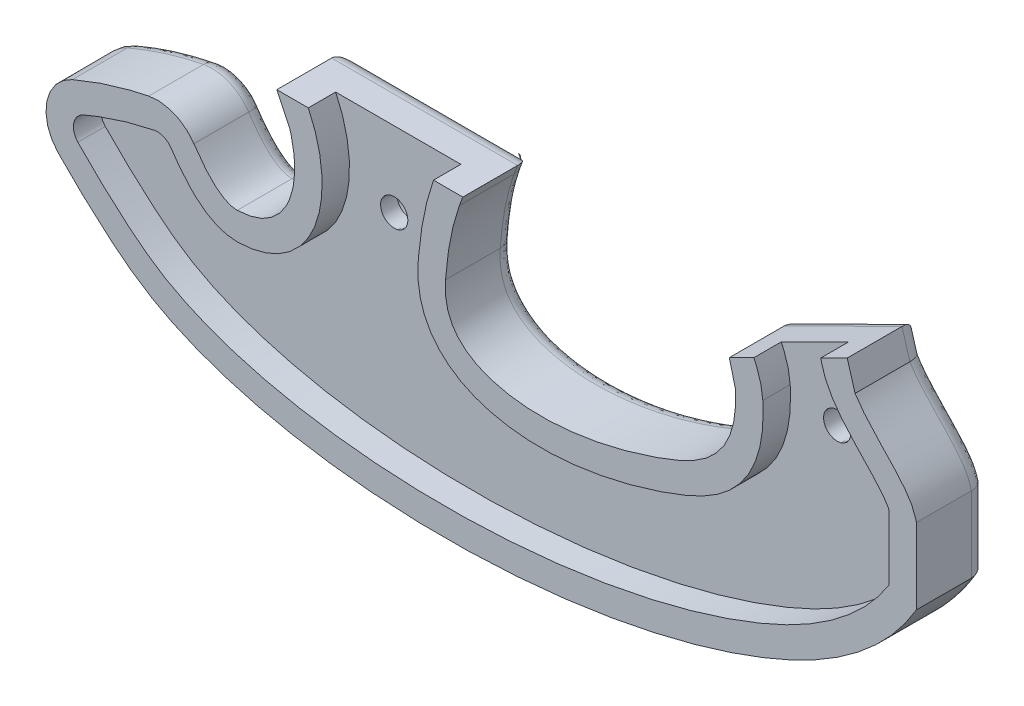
SolidWorks part; units mm, degrees
ref_plane "Front Plane" through (0, 0, 0) normal (0, 0, 1) x (1, 0, 0)
ref_plane "Top Plane" through (0, 0, 0) normal (0, 1, 0) x (1, 0, 0)
ref_plane "Right Plane" through (0, 0, 0) normal (1, 0, 0) x (0, 0, -1)
sketch "Sketch1" plane through (0, 0, 0) normal (0, 0, 1) x (1, 0, 0)
  line L0 (79.2504, -115.4644) -> (79.2504, -101.6424)
  line L5 (0, 0) -> (0, 0)
  line L12 (-35.1375, -96.6123) -> (-37.5102, -91.6123)
  line L13 (68.0435, -86.8465) -> (66.6096, -81.9755)
  line L14 (49.5621, -90.4507) -> (45.0848, -92.6766)
  line L15 (-3.553, -91.6123) -> (-8.908, -91.6123)
  line L16 (-67.1249, -96.6857) -> (-37.5102, -91.6123) construction
  line L17 (-64.2501, -101.266) -> (-37.085, -96.6123) construction
  line L18 (66.6096, -81.9755) -> (81.1993, -47.4105) construction
  line L19 (70.4952, -85.6276) -> (86.1993, -48.4225) construction
  line L20 (81.1993, 47.4105) -> (66.6096, 81.9755) construction
  line L21 (86.1993, 48.4225) -> (70.4952, 85.6276) construction
  line L22 (74.2504, 114.0311) -> (-73.8224, 118.0757) construction
  line L23 (79.2504, 118.8964) -> (-75.3218, 123.1185) construction
  line L30 (-37.5102, -91.6123) -> (-31.761, -91.6123)
  line L31 (74.2504, -114.0311) -> (74.2504, -102.2592)
  line L32 (61.7915, -84.3708) -> (66.6096, -81.9755)
  line L36 (-37.085, -96.6123) -> (-35.1375, -96.6123) construction
  line L37 (-87.8722, -63.9899) -> (-87.8722, -94.5192) construction
  line L38 (-92.8722, -63.9899) -> (-92.8722, -94.5192) construction
  line L39 (-82.8722, -99.5192) -> (-71.6312, -99.5192) construction
  line L40 (-82.8722, -104.5192) -> (-71.6312, -104.5192) construction
  line L41 (68.0435, -86.8465) -> (70.4952, -85.6276) construction
  line L42 (81.1993, -47.4105) -> (81.1993, 47.4105) construction
  line L43 (86.1993, -48.4225) -> (86.1993, 48.4225) construction
  line L44 (-74.6877, 34.8695) -> (-74.6877, -34.8695) construction
  line L45 (-69.6877, 36.0776) -> (-69.6877, -36.0776) construction
  line L46 (-4.0919, -2.8841) -> (-67.1249, 96.6857) construction
  line L47 (0, 0) -> (-62.7714, 99.1566) construction
  line L48 (-56.8037, 110.4905) -> (-48.5642, 116.4338) construction
  line L49 (-53.3217, 106.8371) -> (-50.5489, 108.8371) construction
  line L50 (-48.5642, 116.4338) -> (22.8691, -37.3697) construction
  line L51 (-50.5489, 108.8371) -> (0, 0) construction
  line L52 (-71.6312, 99.5192) -> (-82.8722, 99.5192) construction
  line L53 (-71.6312, 104.5192) -> (-82.8722, 104.5192) construction
  line L54 (-72.8338, 113.2617) -> (-59.8954, 109.2083) construction
  line L55 (-74.5186, 108.5499) -> (-61.2, 104.3774) construction
  line L56 (-92.8722, 94.5192) -> (-92.8722, 63.9899) construction
  line L57 (-87.8722, 94.5192) -> (-87.8722, 63.9899) construction
  line L58 (-78.9079, 54.0436) -> (-69.6877, 36.0776) construction
  line L59 (-82.2731, 49.65) -> (-74.6877, 34.8695) construction
  line L60 (61.7915, 84.3708) -> (74.2504, 102.2592) construction
  line L61 (69.2063, 86.2684) -> (79.2504, 100.6895) construction
  line L62 (74.2504, 102.2592) -> (74.2504, 114.0311) construction
  line L63 (79.2504, 100.6895) -> (79.2504, 118.8964) construction
  line L64 (66.6096, 81.9755) -> (61.7915, 84.3708) construction
  line L65 (70.4952, 85.6276) -> (69.2063, 86.2684) construction
  line L66 (22.8691, -37.3697) -> (-4.0919, -2.8841) construction
  line L67 (-69.6877, -36.0776) -> (-78.9079, -54.0436) construction
  line L68 (-74.6877, -34.8695) -> (-82.2731, -49.65) construction
  line L69 (-4.1958, -93.2842) -> (-3.553, -91.6123)
  line L70 (51.2032, -96.3773) -> (49.5621, -90.4507) construction
  line L71 (46.2395, -97.188) -> (44.7434, -91.785) construction
  line L72 (46.2395, -97.188) -> (45.0848, -92.6766)
  arc A0 (-52.6376, -107.7258) -> (-60.8822, -104.3067) centre (-59.3034, -112.1493) ccw
  arc A1 (-74.8197, -108.673) -> (-77.4561, -121.5104) centre (-71.6422, -116.015) ccw
  arc A27 (-56.8037, -110.4905) -> (-59.8954, -109.2083) centre (-59.3034, -112.1493) ccw
  arc A28 (-72.8338, -113.2617) -> (-73.8224, -118.0757) centre (-71.6422, -116.015) ccw
  arc A30 (-92.8722, -94.5192) -> (-82.8722, -104.5192) centre (-82.8722, -94.5192) ccw construction
  arc A31 (-87.8722, -94.5192) -> (-82.8722, -99.5192) centre (-82.8722, -94.5192) ccw construction
  arc A32 (-71.6312, -104.5192) -> (-64.2501, -101.266) centre (-71.6312, -94.5192) ccw construction
  arc A33 (-71.6312, -99.5192) -> (-67.1249, -96.6857) centre (-71.6312, -94.5192) ccw construction
  arc A34 (-82.8722, 104.5192) -> (-92.8722, 94.5192) centre (-82.8722, 94.5192) ccw construction
  arc A35 (-82.8722, 99.5192) -> (-87.8722, 94.5192) centre (-82.8722, 94.5192) ccw construction
  arc A36 (-61.2, 104.3774) -> (-53.3217, 106.8371) centre (-59.3034, 112.1493) ccw construction
  arc A37 (-59.8954, 109.2083) -> (-56.8037, 110.4905) centre (-59.3034, 112.1493) ccw construction
  arc A38 (-62.7714, 99.1566) -> (-71.6312, 104.5192) centre (-71.6312, 94.5192) ccw construction
  arc A39 (-73.8224, 118.0757) -> (-72.8338, 113.2617) centre (-71.6422, 116.015) ccw construction
  arc A40 (-75.3218, 123.1185) -> (-74.5186, 108.5499) centre (-71.6422, 116.015) ccw construction
  arc A41 (-87.8722, 63.9899) -> (-78.9079, 54.0436) centre (-77.8722, 63.9899) ccw construction
  arc A42 (-92.8722, 63.9899) -> (-82.2731, 49.65) centre (-77.8722, 63.9899) ccw construction
  arc A43 (-67.1249, 96.6857) -> (-71.6312, 99.5192) centre (-71.6312, 94.5192) ccw construction
  arc A44 (-78.9079, -54.0436) -> (-87.8722, -63.9899) centre (-77.8722, -63.9899) ccw construction
  arc A45 (-82.2731, -49.65) -> (-92.8722, -63.9899) centre (-77.8722, -63.9899) ccw construction
  spline S0 degree 1 poles (-35.1375, -96.6123) (-44.7243, -114.2851) knots 0 0 1 1 construction
  spline S1 degree 1 poles (-44.7243, -114.2851) (-52.6376, -107.7258) knots 0 0 1 1 construction
  spline S2 degree 1 poles (-60.8822, -104.3067) (-74.8197, -108.673) knots 0 0 1 1 construction
  spline S3 degree 1 poles (-77.4561, -121.5104) (79.2504, -115.4644) knots 0 0 1 1 construction
  spline S4 degree 1 poles (79.2504, -101.6424) (68.0435, -86.8465) knots 0 0 1 1 construction
  spline S5 degree 1 poles (-4.1958, -93.2842) (-6.7149, -106.2712) knots 0 0 1 1 construction
  spline S6 degree 1 poles (-6.7149, -106.2712) (46.2395, -97.188) knots 0 0 1 1 construction
  spline S8 degree 3 poles (-4.1958, -93.2842) (-4.5548, -94.2961) (-5.1781, -96.3372) (-5.8996, -99.5536) (-6.4155, -102.8759) (-6.6342, -105.1411) (-6.7149, -106.2712) knots 0.844181 0.844181 0.844181 0.844181 0.883136 0.922091 0.961045 1 1 1 1
  spline S9 degree 3 poles (-6.7149, -106.2712) (-6.7402, -106.6253) (-6.7698, -107.3462) (-6.7331, -108.7012) (-6.5053, -110.3043) (-5.9364, -112.0151) (-5.063, -113.5348) (-3.904, -114.8555) (-2.324, -116.1074) (-0.9184, -116.8961) (0.3557, -117.4376) (1.7707, -117.9392) (3.5951, -118.4334) (6.6459, -118.9735) (10.7037, -119.2191) (15.657, -118.9333) (20.6472, -118.1868) (25.6654, -117.0431) (30.6127, -115.5522) (35.5215, -113.7684) (39.6862, -111.7117) (42.8877, -109.0511) (44.67, -106.3305) (45.6122, -103.7779) (46.0621, -101.7216) (46.2801, -99.5126) (46.2739, -97.9551) (46.2395, -97.188) knots 0 0 0 0 0.015522 0.031044 0.062088 0.093132 0.124176 0.155219 0.186263 0.217307 0.232829 0.248351 0.279395 0.310439 0.372527 0.434614 0.496702 0.55879 0.620878 0.682965 0.745053 0.807141 0.869229 0.900272 0.931316 0.96236 0.993404 0.993404 0.993404 0.993404
  spline S16 degree 3 poles (-35.1375, -96.6123) (-34.4895, -98.6761) (-34.0053, -102.0357) (-34.5537, -106.1678) (-35.5655, -108.9609) (-37.1446, -111.25) (-39.2177, -112.9391) (-41.3246, -113.8201) (-43.2063, -114.1966) (-44.2233, -114.2739) (-44.7243, -114.2851) knots 0.632471 0.632471 0.632471 0.632471 0.724353 0.770294 0.816235 0.862176 0.908118 0.954059 0.977029 1 1 1 1
  spline S17 degree 3 poles (-44.7243, -114.2851) (-45.0101, -114.2914) (-45.5611, -114.2422) (-46.8016, -113.8648) (-48.1732, -112.9957) (-49.594, -111.6551) (-50.6289, -110.4898) (-51.652, -109.1674) (-52.3183, -108.207) (-52.6376, -107.7258) knots 0 0 0 0 0.111109 0.222219 0.444438 0.555547 0.666656 0.777766 0.888875 0.888875 0.888875 0.888875
  spline S18 degree 3 poles (-60.8822, -104.3067) (-62.0784, -104.5475) (-64.4598, -105.0944) (-67.9747, -106.0966) (-71.4353, -107.2792) (-73.7005, -108.1887) (-74.8197, -108.673) knots 0.104554 0.104554 0.104554 0.104554 0.275997 0.44744 0.618884 0.790327 0.790327 0.790327 0.790327
  spline S19 degree 3 poles (-77.4561, -121.5104) (-76.2138, -122.8246) (-74.2805, -124.7513) (-71.6518, -127.1769) (-69.0526, -129.5049) (-66.2702, -131.8802) (-63.2175, -134.1302) (-59.928, -136.2642) (-55.7304, -138.4425) (-50.6441, -140.5241) (-45.4894, -142.2138) (-40.2773, -143.5891) (-35.0002, -144.7008) (-27.9955, -145.8593) (-15.7593, -147.1548) (-1.8012, -147.2823) (12.2469, -146.2151) (22.6616, -144.8081) (32.9645, -142.7692) (43.1488, -140.0168) (53.2499, -136.4138) (61.4926, -132.429) (67.7773, -128.2217) (71.4312, -125.1567) (74.1253, -122.4268) (75.7053, -120.5917) (76.9013, -119.0349) (77.6188, -118.021) (78.0999, -117.2952) (78.3744, -116.8668) (78.6267, -116.4628) (78.9027, -116.021) (79.1355, -115.6483) (79.2504, -115.4644) knots 0.024499 0.024499 0.024499 0.024499 0.055248 0.070623 0.085997 0.116746 0.132121 0.147495 0.178244 0.208993 0.239742 0.270491 0.30124 0.331989 0.393487 0.516483 0.577981 0.639479 0.700977 0.762475 0.823973 0.885471 0.91622 0.946969 0.962343 0.977718 0.985405 0.993092 0.996936 0.998858 1.000779 1.004623 1.008467 1.008467 1.008467 1.008467
  spline S20 degree 3 poles (51.2032, -96.3773) (51.1419, -95.3856) (50.9766, -94.4206) (50.5939, -93.0077) (50.4437, -92.5426) (50.1003, -91.6234) (49.9063, -91.1674) (49.6506, -90.6306) (49.6067, -90.5404) (49.5621, -90.4507) knots 0.934325 0.934325 0.934325 0.934325 0.965575 0.965575 0.9812 0.9812 0.996825 0.996825 1 1 1 1
  spline S22 degree 3 poles (-8.908, -91.6123) (-9.2287, -92.5161) (-9.5169, -93.4302) (-10.3038, -96.2246) (-10.7138, -98.1326) (-11.3446, -102.0078) (-11.5623, -103.957) (-11.7022, -105.9149) knots 0.844181 0.844181 0.844181 0.844181 0.875 0.875 0.9375 0.9375 1 1 1 1
  spline S23 degree 3 poles (-11.7022, -105.9149) (-11.7686, -106.8449) (-11.7783, -107.7707) (-11.6596, -109.612) (-11.5314, -110.5275) (-11.211, -111.8914) (-11.0835, -112.3402) (-10.7881, -113.2176) (-10.4516, -114.0774) (-10.0301, -114.9008) (-9.5644, -115.7052) (-9.3081, -116.0995) (-8.4891, -117.2282) (-7.8727, -117.9159) (-6.8554, -118.8624) (-6.4999, -119.1644) (-5.7655, -119.7401) (-5.3893, -120.0118) (-4.2339, -120.7778) (-3.4272, -121.2225) (-2.168, -121.8004) (-1.7402, -121.9784) (-0.8709, -122.3094) (-0.4303, -122.4627) (1.7765, -123.1688) (3.5764, -123.5473) (6.3144, -123.9081) (7.2335, -123.9935) (9.0831, -124.1025) (10.0118, -124.1258) (12.7789, -124.1143) (14.6103, -123.9998) (18.2526, -123.6064) (20.0634, -123.3272) (23.6679, -122.6311) (25.4634, -122.2136) (29.0312, -121.2568) (30.7942, -120.7201) (33.4093, -119.8333) (34.2761, -119.5239) (35.9996, -118.8776) (36.8563, -118.5402) (38.5501, -117.8112) (39.3893, -117.4188) (41.0298, -116.5574) (41.8255, -116.0913) (43.3551, -115.0704) (44.0892, -114.5157) (45.1349, -113.6039) (45.4756, -113.2852) (46.1287, -112.6272) (47.0659, -111.6102) (48.144, -110.1329) (48.822, -108.9326) (49.2447, -108.1117) (49.4421, -107.689) (50.3443, -105.5508) (50.7974, -103.7663) (51.2867, -100.0823) (51.3177, -98.2309) (51.2032, -96.3773) knots 0 0 0 0 0.03125 0.03125 0.0625 0.0625 0.078125 0.078125 0.09375 0.109375 0.109375 0.125 0.125 0.15625 0.15625 0.171875 0.171875 0.1875 0.1875 0.21875 0.21875 0.234375 0.234375 0.25 0.25 0.3125 0.3125 0.34375 0.34375 0.375 0.375 0.4375 0.4375 0.5 0.5 0.5625 0.5625 0.625 0.625 0.65625 0.65625 0.6875 0.6875 0.71875 0.71875 0.75 0.75 0.78125 0.78125 0.796875 0.796875 0.8125 0.84375 0.859375 0.859375 0.875 0.875 0.9375 0.9375 1 1 1 1
  spline S24 degree 3 poles (79.2504, -101.6424) (79.2391, -101.5973) (79.2165, -101.507) (79.1825, -101.3713) (79.1543, -101.259) (79.1314, -101.1673) (79.1181, -101.1143) (79.1067, -101.0686) (79.1039, -101.0576) (79.0976, -101.0321) (79.067, -100.9136) (79.0288, -100.7799) (78.9541, -100.5438) (78.8691, -100.3124) (78.8005, -100.1448) (78.767, -100.0652) (78.7161, -99.9476) (78.6362, -99.7719) (78.4818, -99.456) (78.2777, -99.0828) (78.0458, -98.697) (77.8214, -98.3489) (77.5226, -97.9124) (77.1688, -97.432) (76.6069, -96.7153) (75.9194, -95.9073) (75.1317, -95.0308) (74.0833, -93.9067) (72.8314, -92.6059) (71.4098, -91.1047) (70.104, -89.6462) (69.1513, -88.4679) (68.4794, -87.5303) (68.1863, -87.0797) (68.0435, -86.8465) knots -0.009552 -0.009552 -0.009552 -0.009552 -0.007389 -0.005225 -0.003062 -0.00198 -0.000898 -0.000357 -0.000087 0.000048 0.000184 0.000724 0.001265 0.002347 0.003429 0.00397 0.004511 0.005592 0.007756 0.012083 0.01641 0.020737 0.025064 0.033718 0.042372 0.05968 0.076988 0.094296 0.128911 0.163527 0.198143 0.232759 0.250067 0.267375 0.267375 0.267375 0.267375
  spline S39 degree 3 poles (-31.761, -91.6123) (-31.7177, -91.7008) (-31.675, -91.7896) (-31.4326, -92.3013) (-31.2434, -92.7319) (-30.8902, -93.6013) (-30.7265, -94.0392) (-29.9709, -96.2438) (-29.5631, -98.0553) (-29.3145, -100.3834) (-29.2781, -100.8534) (-29.234, -101.789) (-29.2261, -102.2557) (-29.2457, -103.6521) (-29.3161, -104.5785) (-29.5164, -105.9603) (-29.5991, -106.4197) (-29.7985, -107.3356) (-29.9159, -107.7936) (-30.3172, -109.1415) (-30.651, -110.0113) (-31.2604, -111.2689) (-31.4817, -111.6802) (-31.9634, -112.4858) (-32.2248, -112.8813) (-33.0536, -114.0154) (-33.6693, -114.7102) (-34.6903, -115.6581) (-35.0469, -115.9583) (-35.7939, -116.5259) (-36.1858, -116.7939) (-37.3849, -117.5295) (-38.2236, -117.9359) (-39.5368, -118.4272) (-39.9847, -118.5714) (-40.895, -118.8197) (-41.3533, -118.9228) (-42.7364, -119.1734) (-43.6697, -119.2628) (-44.6129, -119.2838) knots 0.590454 0.590454 0.590454 0.590454 0.59375 0.59375 0.609375 0.609375 0.625 0.625 0.6875 0.6875 0.703125 0.703125 0.71875 0.71875 0.75 0.75 0.765625 0.765625 0.78125 0.78125 0.8125 0.8125 0.828125 0.828125 0.84375 0.84375 0.875 0.875 0.890625 0.890625 0.90625 0.90625 0.9375 0.9375 0.953125 0.953125 0.96875 0.96875 1 1 1 1
  spline S40 degree 3 poles (-44.6129, -119.2838) (-45.3582, -119.3004) (-46.0883, -119.2214) (-47.1633, -118.9755) (-47.5194, -118.8717) (-48.22, -118.6245) (-48.5603, -118.4826) (-49.5551, -118.0093) (-50.1833, -117.6301) (-51.0842, -116.9859) (-51.378, -116.758) (-51.9451, -116.2869) (-52.2197, -116.0429) (-53.5542, -114.787) (-54.5037, -113.6716) (-55.8319, -111.9084) (-56.2573, -111.3058) (-56.7131, -110.6266) (-56.7585, -110.5586) (-56.8037, -110.4905) knots 0 0 0 0 0.125 0.125 0.1875 0.1875 0.25 0.25 0.375 0.375 0.4375 0.4375 0.5 0.5 0.75 0.75 0.875 0.875 0.888875 0.888875 0.888875 0.888875
  spline S41 degree 3 poles (-59.8954, -109.2083) (-60.8367, -109.3978) (-61.7734, -109.609) (-64.3079, -110.2394) (-65.8949, -110.6989) (-69.0293, -111.7354) (-70.5782, -112.3134) (-72.3449, -113.052) (-72.5897, -113.1561) (-72.8338, -113.2617) knots 0.104554 0.104554 0.104554 0.104554 0.25 0.25 0.5 0.5 0.75 0.75 0.790327 0.790327 0.790327 0.790327
  spline S42 degree 3 poles (-73.8224, -118.0757) (-73.5631, -118.3501) (-73.3022, -118.6227) (-71.8246, -120.1473) (-70.5732, -121.361) (-68.6562, -123.1373) (-68.011, -123.7225) (-66.7128, -124.8843) (-66.0609, -125.4622) (-64.0831, -127.1712) (-62.7332, -128.2758) (-60.612, -129.8261) (-59.8891, -130.3252) (-58.4045, -131.2807) (-57.6504, -131.7307) (-55.3624, -133.006) (-53.8014, -133.7608) (-50.6277, -135.132) (-49.0147, -135.7478) (-45.7477, -136.8693) (-44.0935, -137.3747) (-40.7507, -138.2936) (-39.0621, -138.7069) (-36.5067, -139.2667) (-35.6515, -139.4431) (-33.9421, -139.7756) (-33.0869, -139.9319) (-28.8085, -140.6669) (-25.3782, -141.108) (-18.5056, -141.7527) (-15.0631, -141.9555) (-8.1674, -142.1495) (-4.7141, -142.1404) (0.4736, -141.9749) (2.2041, -141.8943) (5.6678, -141.6822) (7.4031, -141.5505) (12.5957, -141.0794) (16.0353, -140.6651) (22.8686, -139.6293) (26.2624, -139.008) (32.9998, -137.538) (36.3434, -136.6896) (42.9717, -134.7265) (46.2567, -133.613) (51.1277, -131.6872) (52.7323, -131.0047) (55.8832, -129.5356) (57.4305, -128.7486) (60.454, -127.0418) (61.93, -126.1218) (64.0786, -124.6197) (64.7853, -124.0976) (66.1593, -123.0211) (66.8284, -122.4658) (68.7782, -120.7452) (70.002, -119.5257) (72.2709, -116.9163) (73.3162, -115.5267) (74.2504, -114.0311) knots 0.024499 0.024499 0.024499 0.024499 0.03125 0.03125 0.0625 0.0625 0.078125 0.078125 0.09375 0.09375 0.125 0.125 0.140625 0.140625 0.15625 0.15625 0.1875 0.1875 0.21875 0.21875 0.25 0.25 0.28125 0.28125 0.296875 0.296875 0.3125 0.3125 0.375 0.375 0.4375 0.4375 0.5 0.5 0.53125 0.53125 0.5625 0.5625 0.625 0.625 0.6875 0.6875 0.75 0.75 0.8125 0.8125 0.84375 0.84375 0.875 0.875 0.90625 0.90625 0.921875 0.921875 0.9375 0.9375 0.96875 0.96875 1 1 1 1
  spline S43 degree 3 poles (74.2504, -102.2592) (74.23, -102.1776) (74.1996, -102.1019) (74.1359, -101.9521) (74.0316, -101.7326) (73.911, -101.5226) (73.6576, -101.1097) (73.4722, -100.844) (72.8904, -100.0621) (72.4729, -99.5665) (71.189, -98.11) (70.2889, -97.1792) (68.5006, -95.3065) (67.609, -94.3666) (65.906, -92.4255) (65.0935, -91.4253) (64.0011, -89.8284) (63.6582, -89.2798) (63.031, -88.138) (62.7504, -87.5505) (62.2774, -86.3501) (62.0846, -85.7349) (61.8826, -84.8619) (61.8335, -84.6171) (61.7915, -84.3708) knots 0 0 0 0 0.003906 0.003906 0.007813 0.015625 0.015625 0.03125 0.03125 0.0625 0.0625 0.125 0.125 0.1875 0.1875 0.25 0.25 0.28125 0.28125 0.3125 0.3125 0.34375 0.34375 0.355726 0.355726 0.355726 0.355726
  dimension "D1" = 5
  dimension "D2" = 5
extrude "Boss-Extrude1" add sketch "Sketch1" against normal blind 13 contours S22 S23 S20 L14 L72 S9 S8 L69 L15 | S41 A28 S42 L31 S43 L32 L13 S24 L0 S19 A1 S18 A0 S17 S16 L12 L30 S39 S40 A27
sketch "Sketch2" plane through (0, 0, -13) normal (0, 0, -1) x (-1, 0, 0)
  line L0 (37.5102, -91.6123) -> (31.761, -91.6123)
  line L1 (31.761, -91.6123) -> (8.908, -91.6123)
  line L2 (-49.5621, -90.4507) -> (-61.7915, -84.3708)
  line L4 (8.908, -91.6123) -> (3.553, -91.6123)
  line L5 (3.553, -91.6123) -> (4.1958, -93.2842)
  line L6 (-74.2504, -114.0311) -> (-74.2504, -102.2592)
  line L7 (-61.7915, -84.3708) -> (-66.6096, -81.9755)
  line L8 (-66.6096, -81.9755) -> (-68.0435, -86.8465)
  line L9 (-79.2504, -101.6424) -> (-79.2504, -115.4644)
  line L10 (35.1375, -96.6123) -> (37.5102, -91.6123)
  line L11 (37.5102, -91.6123) -> (31.761, -91.6123)
  line L13 (-61.7915, -84.3708) -> (-66.6096, -81.9755)
  line L14 (-66.6096, -81.9755) -> (-68.0435, -86.8465)
  line L15 (-79.2504, -101.6424) -> (-79.2504, -115.4644)
  line L16 (35.1375, -96.6123) -> (37.5102, -91.6123)
  line L18 (-46.2395, -97.188) -> (-45.0848, -92.6766)
  line L19 (-45.0848, -92.6766) -> (-49.5621, -90.4507)
  line L20 (8.908, -91.6123) -> (3.553, -91.6123)
  line L21 (3.553, -91.6123) -> (4.1958, -93.2842)
  line L22 (-46.2395, -97.188) -> (-45.0848, -92.6766)
  line L23 (-45.0848, -92.6766) -> (-49.5621, -90.4507)
  circle A3 centre (-59.7793, -98.549) radius 2.5
  arc A4 (59.8954, -109.2083) -> (56.8037, -110.4905) centre (59.3034, -112.1493) ccw
  arc A5 (73.8224, -118.0757) -> (72.8338, -113.2617) centre (71.6422, -116.015) ccw
  arc A6 (77.4561, -121.5104) -> (74.8197, -108.673) centre (71.6422, -116.015) ccw
  arc A7 (60.8822, -104.3067) -> (52.6376, -107.7258) centre (59.3034, -112.1493) ccw
  arc A10 (77.4561, -121.5104) -> (74.8197, -108.673) centre (71.6422, -116.015) ccw
  arc A11 (60.8822, -104.3067) -> (52.6376, -107.7258) centre (59.3034, -112.1493) ccw
  circle A13 centre (21.0762, -105.2979) radius 2.5
  spline S5 degree 3 poles (1008.0299, -191.5266) (-136.1442, -284.2891) (24.3373, -181.8322) (10.7138, -98.1326) (10.3038, -96.2246) (-4.4679, -43.7691) (-103.7867, -19.7223) (-980.2961, -238.1044) knots -1.730691 -1.730691 -1.730691 -1.730691 0.906681 0.906681 0.969181 0.969181 2.658415 2.658415 2.658415 2.658415 only from (11.7022, -105.9149) to (8.908, -91.6123)
  spline S6 degree 3 poles (-1929.4414, 2199.613) (-117.6287, -57.0299) (-6.9636, -42.2061) (5.8996, -99.5536) (16.6176, -168.5785) (-90.5642, -283.8483) (274.4298, 2880.8232) knots -1.122583 -1.122583 -1.122583 -1.122583 0.883136 0.922091 0.961045 3.311129 3.311129 3.311129 3.311129 only from (4.1958, -93.2842) to (6.7149, -106.2712)
  spline S7 degree 3 poles (163.6783, -3101.9354) (-32.2998, -32.521) (7.2823, -88.427) (6.7331, -108.7012) (6.5053, -110.3043) (5.9364, -112.0151) (5.063, -113.5348) (3.904, -114.8555) (2.324, -116.1074) (0.9184, -116.8961) (-0.3557, -117.4376) (-1.7707, -117.9392) (-3.5951, -118.4334) (-6.6459, -118.9735) (-10.7037, -119.2191) (-15.657, -118.9333) (-20.6472, -118.1868) (-25.6654, -117.0431) (-30.6127, -115.5522) (-35.5215, -113.7684) (-39.6862, -111.7117) (-42.8877, -109.0511) (-44.67, -106.3305) (-45.6122, -103.7779) (-46.0621, -101.7216) (-49.5501, -66.3898) (30.7188, 15.0586) (-457.5658, -3068.1749) knots -0.866906 -0.866906 -0.866906 -0.866906 0.015522 0.031044 0.062088 0.093132 0.124176 0.155219 0.186263 0.217307 0.232829 0.248351 0.279395 0.310439 0.372527 0.434614 0.496702 0.55879 0.620878 0.682965 0.745053 0.807141 0.869229 0.900272 0.931316 0.96236 2.389858 2.389858 2.389858 2.389858 only from (6.7149, -106.2712) to (-46.2395, -97.188)
  spline S8 degree 3 poles (-792.8836, 578.4832) (125.7681, -105.0665) (-30.6538, -50.7484) (-49.9063, -91.1674) (-50.1003, -91.6234) (-50.4437, -92.5426) (-50.5939, -93.0077) (-59.7681, -126.8739) (44.2134, -189.3273) (887.2273, -441.778) knots -0.462371 -0.462371 -0.462371 -0.462371 0.9375 0.9375 0.953125 0.953125 0.96875 0.96875 2.076719 2.076719 2.076719 2.076719 only from (-49.5621, -90.4507) to (-51.2032, -96.3773)
  spline S9 degree 3 poles (-1051.1251, -83.8977) (101.3942, 8.1233) (-57.8623, -50.5753) (-50.7974, -103.7663) (-50.3443, -105.5508) (-49.4421, -107.689) (-49.2447, -108.1117) (-48.822, -108.9326) (-48.144, -110.1329) (-47.0659, -111.6102) (-46.1287, -112.6272) (-45.4756, -113.2852) (-45.1349, -113.6039) (-44.0892, -114.5157) (-43.3551, -115.0704) (-41.8255, -116.0913) (-41.0298, -116.5574) (-39.3893, -117.4188) (-38.5501, -117.8112) (-36.8563, -118.5402) (-35.9996, -118.8776) (-34.2761, -119.5239) (-33.4093, -119.8333) (-30.7942, -120.7201) (-29.0312, -121.2568) (-25.4634, -122.2136) (-23.6679, -122.6311) (-20.0634, -123.3272) (-18.2526, -123.6064) (-14.6103, -123.9998) (-12.7789, -124.1143) (-10.0118, -124.1258) (-9.0831, -124.1025) (-7.2335, -123.9935) (-6.3144, -123.9081) (-3.5764, -123.5473) (-1.7765, -123.1688) (0.4303, -122.4627) (0.8709, -122.3094) (1.7402, -121.9784) (2.168, -121.8004) (3.4272, -121.2225) (4.2339, -120.7778) (5.3893, -120.0118) (5.7655, -119.7401) (6.4999, -119.1644) (6.8554, -118.8624) (7.8727, -117.9159) (8.4891, -117.2282) (9.3081, -116.0995) (9.5644, -115.7052) (10.0301, -114.9008) (10.4516, -114.0774) (10.7881, -113.2176) (11.0835, -112.3402) (11.211, -111.8914) (11.5314, -110.5275) (11.6596, -109.612) (14.6681, -62.942) (-152.7666, -4.596) (1009.8064, -44.5799) knots -1.679832 -1.679832 -1.679832 -1.679832 0.0625 0.0625 0.125 0.125 0.140625 0.140625 0.15625 0.1875 0.203125 0.203125 0.21875 0.21875 0.25 0.25 0.28125 0.28125 0.3125 0.3125 0.34375 0.34375 0.375 0.375 0.4375 0.4375 0.5 0.5 0.5625 0.5625 0.625 0.625 0.65625 0.65625 0.6875 0.6875 0.75 0.75 0.765625 0.765625 0.78125 0.78125 0.8125 0.8125 0.828125 0.828125 0.84375 0.84375 0.875 0.875 0.890625 0.890625 0.90625 0.921875 0.921875 0.9375 0.9375 0.96875 0.96875 2.521629 2.521629 2.521629 2.521629 only from (-51.2032, -96.3773) to (11.7022, -105.9149)
  spline S10 degree 3 poles (-376.2112, -1009.1032) (-123.6143, -215.1803) (-14.9697, -90.5192) (64.3079, -110.2394) (65.8949, -110.6989) (69.0293, -111.7354) (70.5782, -112.3134) (160.3985, -149.8634) (162.4669, -385.672) (716.6221, 651.931) knots -11.869252 -11.869252 -11.869252 -11.869252 0.25 0.25 0.5 0.5 0.75 0.75 15.259992 15.259992 15.259992 15.259992 only from (59.8954, -109.2083) to (72.8338, -113.2617)
  spline S11 degree 3 poles (895.6522, -687.7918) (112.0267, 65.7348) (126.2936, -63.9497) (71.8246, -120.1473) (70.5732, -121.361) (68.6562, -123.1373) (68.011, -123.7225) (66.7128, -124.8843) (66.0609, -125.4622) (64.0831, -127.1712) (62.7332, -128.2758) (60.612, -129.8261) (59.8891, -130.3252) (58.4045, -131.2807) (57.6504, -131.7307) (55.3624, -133.006) (53.8014, -133.7608) (50.6277, -135.132) (49.0147, -135.7478) (45.7477, -136.8693) (44.0935, -137.3747) (40.7507, -138.2936) (39.0621, -138.7069) (36.5067, -139.2667) (35.6515, -139.4431) (33.9421, -139.7756) (33.0869, -139.9319) (28.8085, -140.6669) (25.3782, -141.108) (18.5056, -141.7527) (15.0631, -141.9555) (8.1674, -142.1495) (4.7141, -142.1404) (-0.4736, -141.9749) (-2.2041, -141.8943) (-5.6678, -141.6822) (-7.4031, -141.5505) (-12.5957, -141.0794) (-16.0353, -140.6651) (-22.8686, -139.6293) (-26.2624, -139.008) (-32.9998, -137.538) (-36.3434, -136.6896) (-42.9717, -134.7265) (-46.2567, -133.613) (-51.1277, -131.6872) (-52.7323, -131.0047) (-55.8832, -129.5356) (-57.4305, -128.7486) (-60.454, -127.0418) (-61.93, -126.1218) (-64.0786, -124.6197) (-64.7853, -124.0976) (-66.1593, -123.0211) (-66.8284, -122.4658) (-68.7782, -120.7452) (-70.002, -119.5257) (-103.2164, -81.3269) (-64.0244, 23.4751) (544.9666, 671.1822) knots -1.338253 -1.338253 -1.338253 -1.338253 0.03125 0.03125 0.0625 0.0625 0.078125 0.078125 0.09375 0.09375 0.125 0.125 0.140625 0.140625 0.15625 0.15625 0.1875 0.1875 0.21875 0.21875 0.25 0.25 0.28125 0.28125 0.296875 0.296875 0.3125 0.3125 0.375 0.375 0.4375 0.4375 0.5 0.5 0.53125 0.53125 0.5625 0.5625 0.625 0.625 0.6875 0.6875 0.75 0.75 0.8125 0.8125 0.84375 0.84375 0.875 0.875 0.90625 0.90625 0.921875 0.921875 0.9375 0.9375 0.96875 0.96875 1.852435 1.852435 1.852435 1.852435 only from (73.8224, -118.0757) to (-74.2504, -114.0311)
  spline S12 degree 3 poles (783.6494, -616.0666) (-73.9419, -110.8566) (-75.6492, -105.5106) (-74.1359, -101.9521) (-74.0316, -101.7326) (-73.911, -101.5226) (-73.6576, -101.1097) (-73.4722, -100.844) (-72.8904, -100.0621) (-72.4729, -99.5665) (-71.189, -98.11) (-70.2889, -97.1792) (-68.5006, -95.3065) (-67.609, -94.3666) (-65.906, -92.4255) (-65.0935, -91.4253) (-64.0011, -89.8284) (-63.6582, -89.2798) (-63.031, -88.138) (-62.7504, -87.5505) (-62.2774, -86.3501) (-62.0846, -85.7349) (-56.8172, -62.9757) (-109.3952, -16.4671) (-359.8779, -1038.9029) knots -0.177819 -0.177819 -0.177819 -0.177819 0.003906 0.003906 0.007813 0.015625 0.015625 0.03125 0.03125 0.0625 0.0625 0.125 0.125 0.1875 0.1875 0.25 0.25 0.28125 0.28125 0.3125 0.3125 0.34375 0.34375 1.439394 1.439394 1.439394 1.439394 only from (-74.2504, -102.2592) to (-61.7915, -84.3708)
  spline S13 degree 3 poles (1319.1396, 2573.0404) (-87.8079, -76.376) (-58.6352, -73.7928) (-69.1513, -88.4679) (-70.104, -89.6462) (-71.4098, -91.1047) (-72.8314, -92.6059) (-74.0833, -93.9067) (-75.1317, -95.0308) (-75.9194, -95.9073) (-76.6069, -96.7153) (-77.1688, -97.432) (-77.5226, -97.9124) (-77.8214, -98.3489) (-78.0458, -98.697) (-78.2777, -99.0828) (-78.4818, -99.456) (-78.6362, -99.7719) (-78.7161, -99.9476) (-78.767, -100.0652) (-78.8005, -100.1448) (-78.8691, -100.3124) (-78.9541, -100.5438) (-79.0288, -100.7799) (-79.067, -100.9136) (-79.0976, -101.0321) (-79.1039, -101.0576) (-79.1067, -101.0686) (-79.1181, -101.1143) (-79.1314, -101.1673) (-79.1543, -101.259) (-79.1825, -101.3713) (-83.058, -116.8427) (-85.5272, -126.5792) (-793.821, -3015.2566) knots -1.023906 -1.023906 -1.023906 -1.023906 0.007756 0.025064 0.05968 0.094296 0.128911 0.163527 0.180835 0.198143 0.215451 0.224105 0.232759 0.237086 0.241413 0.24574 0.250067 0.252231 0.253312 0.253853 0.254394 0.255476 0.256558 0.257098 0.257639 0.257774 0.25791 0.25818 0.258721 0.259803 0.260885 0.263048 0.265211 1.000774 1.000774 1.000774 1.000774 only from (-68.0435, -86.8465) to (-79.2504, -101.6424)
  spline S14 degree 3 poles (1505.1784, -2662.2429) (-110.5517, -65.256) (-86.7065, -103.5292) (-78.6267, -116.4628) (-78.3744, -116.8668) (-78.0999, -117.2952) (-77.6188, -118.021) (-76.9013, -119.0349) (-75.7053, -120.5917) (-74.1253, -122.4268) (-71.4312, -125.1567) (-67.7773, -128.2217) (-61.4926, -132.429) (-53.2499, -136.4138) (-43.1488, -140.0168) (-32.9645, -142.7692) (-22.6616, -144.8081) (-12.2469, -146.2151) (1.8012, -147.2823) (15.7593, -147.1548) (27.9955, -145.8593) (35.0002, -144.7008) (40.2773, -143.5891) (45.4894, -142.2138) (50.6441, -140.5241) (55.7304, -138.4425) (59.928, -136.2642) (63.2175, -134.1302) (66.2702, -131.8802) (69.0526, -129.5049) (71.6518, -127.1769) (132.7802, -70.7727) (157.2868, 86.2248) (-2648.0994, -1365.0173) knots -0.247184 -0.247184 -0.247184 -0.247184 0.028343 0.032186 0.034108 0.03603 0.039874 0.047561 0.055248 0.070623 0.085997 0.116746 0.147495 0.208993 0.270491 0.331989 0.393487 0.454985 0.516483 0.639479 0.700977 0.731726 0.762475 0.793224 0.823973 0.854722 0.885471 0.900845 0.91622 0.946969 0.962343 0.977718 2.377034 2.377034 2.377034 2.377034 only from (-79.2504, -115.4644) to (77.4561, -121.5104)
  spline S15 degree 3 poles (-2872.5917, -496.9578) (195.2064, -498.1377) (186.1875, -146.4924) (67.9747, -106.0966) (-35.8302, -76.4987) (-211.5581, -279.7123) (2139.2291, -2243.7429) knots -16.950025 -16.950025 -16.950025 -16.950025 0.275997 0.44744 0.618884 15.465635 15.465635 15.465635 15.465635 only from (74.8197, -108.673) to (60.8822, -104.3067)
  spline S16 degree 3 poles (-1424.971, -2718.3485) (76.3246, -4.0172) (69.4931, -86.1083) (50.6289, -110.4898) (49.594, -111.6551) (48.1732, -112.9957) (46.8016, -113.8648) (30.9615, -118.6838) (57.4588, -39.3418) (-2947.7894, -312.3454) knots -5.812257 -5.812257 -5.812257 -5.812257 0.111109 0.222219 0.333328 0.444438 0.666656 0.777766 6.119302 6.119302 6.119302 6.119302 only from (52.6376, -107.7258) to (44.7243, -114.2851)
  spline S17 degree 3 poles (-2949.7734, 53.7825) (138.213, -52.8917) (66.0078, -118.7585) (41.3246, -113.8201) (39.2177, -112.9391) (37.1446, -111.25) (35.5655, -108.9609) (34.5537, -106.1678) (28.1248, -57.7275) (231.3914, 50.6432) (-193.2176, -3082.867) knots -0.480926 -0.480926 -0.480926 -0.480926 0.655441 0.678412 0.724353 0.770294 0.816235 0.862176 0.908118 2.970508 2.970508 2.970508 2.970508 only from (44.7243, -114.2851) to (35.1375, -96.6123)
  spline S18 degree 3 poles (965.6073, -449.2812) (258.0822, -92.4691) (56.5777, -39.2155) (31.4326, -92.3013) (31.2434, -92.7319) (30.8902, -93.6013) (30.7265, -94.0392) (29.9709, -96.2438) (29.5631, -98.0553) (29.3145, -100.3834) (29.2781, -100.8534) (29.234, -101.789) (29.2261, -102.2557) (29.2457, -103.6521) (29.3161, -104.5785) (29.5164, -105.9603) (29.5991, -106.4197) (29.7985, -107.3356) (29.9159, -107.7936) (30.3172, -109.1415) (30.651, -110.0113) (31.2604, -111.2689) (31.4817, -111.6802) (31.9634, -112.4858) (32.2248, -112.8813) (33.0536, -114.0154) (33.6693, -114.7102) (34.6903, -115.6581) (35.0469, -115.9583) (35.7939, -116.5259) (36.1858, -116.7939) (37.3849, -117.5295) (38.2236, -117.9359) (39.5368, -118.4272) (39.9847, -118.5714) (40.895, -118.8197) (41.3533, -118.9228) (94.2254, -128.5052) (182.8992, 113.1829) (58.7737, -1119.1607) knots -1.353395 -1.353395 -1.353395 -1.353395 0.59375 0.59375 0.609375 0.609375 0.625 0.625 0.6875 0.6875 0.703125 0.703125 0.71875 0.71875 0.75 0.75 0.765625 0.765625 0.78125 0.78125 0.8125 0.8125 0.828125 0.828125 0.84375 0.84375 0.875 0.875 0.890625 0.890625 0.90625 0.90625 0.9375 0.9375 0.953125 0.953125 0.96875 0.96875 2.744982 2.744982 2.744982 2.744982 only from (31.761, -91.6123) to (44.6129, -119.2838)
  spline S19 degree 3 poles (-192.7515, 852.1353) (-28.1311, -6.367) (19.2669, -125.3565) (47.1633, -118.9755) (47.5194, -118.8717) (48.22, -118.6245) (48.5603, -118.4826) (49.5551, -118.0093) (50.1833, -117.6301) (51.0842, -116.9859) (51.378, -116.758) (51.9451, -116.2869) (52.2197, -116.0429) (53.5542, -114.787) (54.5037, -113.6716) (55.8319, -111.9084) (56.2573, -111.3058) (84.9905, -68.4909) (44.321, 19.6252) (963.9419, -531.3042) knots -4.678167 -4.678167 -4.678167 -4.678167 0.125 0.125 0.1875 0.1875 0.25 0.25 0.375 0.375 0.4375 0.4375 0.5 0.5 0.75 0.75 0.875 0.875 9.504082 9.504082 9.504082 9.504082 only from (44.6129, -119.2838) to (56.8037, -110.4905)
  spline S23 degree 3 poles (-68.0435, -86.8465) (-68.1863, -87.0797) (-68.4794, -87.5303) (-69.1513, -88.4679) (-70.104, -89.6462) (-71.4098, -91.1047) (-72.8314, -92.6059) (-74.0833, -93.9067) (-75.1317, -95.0308) (-75.9194, -95.9073) (-76.6069, -96.7153) (-77.1688, -97.432) (-77.5226, -97.9124) (-77.8214, -98.3489) (-78.0458, -98.697) (-78.2777, -99.0828) (-78.4818, -99.456) (-78.6362, -99.7719) (-78.7161, -99.9476) (-78.767, -100.0652) (-78.8005, -100.1448) (-78.8691, -100.3124) (-78.9541, -100.5438) (-79.0288, -100.7799) (-79.067, -100.9136) (-79.0976, -101.0321) (-79.1039, -101.0576) (-79.1067, -101.0686) (-79.1181, -101.1143) (-79.1314, -101.1673) (-79.1543, -101.259) (-79.1825, -101.3713) (-79.2165, -101.507) (-79.2391, -101.5973) (-79.2504, -101.6424) knots -0.009552 -0.009552 -0.009552 -0.009552 0.007756 0.025064 0.05968 0.094296 0.128911 0.163527 0.180835 0.198143 0.215451 0.224105 0.232759 0.237086 0.241413 0.24574 0.250067 0.252231 0.253312 0.253853 0.254394 0.255476 0.256558 0.257098 0.257639 0.257774 0.25791 0.25818 0.258721 0.259803 0.260885 0.263048 0.265211 0.267375 0.267375 0.267375 0.267375
  spline S24 degree 3 poles (-79.2504, -115.4644) (-79.1355, -115.6483) (-78.9027, -116.021) (-78.6267, -116.4628) (-78.3744, -116.8668) (-78.0999, -117.2952) (-77.6188, -118.021) (-76.9013, -119.0349) (-75.7053, -120.5917) (-74.1253, -122.4268) (-71.4312, -125.1567) (-67.7773, -128.2217) (-61.4926, -132.429) (-53.2499, -136.4138) (-43.1488, -140.0168) (-32.9645, -142.7692) (-22.6616, -144.8081) (-12.2469, -146.2151) (1.8012, -147.2823) (15.7593, -147.1548) (27.9955, -145.8593) (35.0002, -144.7008) (40.2773, -143.5891) (45.4894, -142.2138) (50.6441, -140.5241) (55.7304, -138.4425) (59.928, -136.2642) (63.2175, -134.1302) (66.2702, -131.8802) (69.0526, -129.5049) (71.6518, -127.1769) (74.2805, -124.7513) (76.2138, -122.8246) (77.4561, -121.5104) knots 0.024499 0.024499 0.024499 0.024499 0.028343 0.032186 0.034108 0.03603 0.039874 0.047561 0.055248 0.070623 0.085997 0.116746 0.147495 0.208993 0.270491 0.331989 0.393487 0.454985 0.516483 0.639479 0.700977 0.731726 0.762475 0.793224 0.823973 0.854722 0.885471 0.900845 0.91622 0.946969 0.962343 0.977718 1.008467 1.008467 1.008467 1.008467
  spline S25 degree 3 poles (74.8197, -108.673) (73.7005, -108.1887) (71.4353, -107.2792) (67.9747, -106.0966) (64.4598, -105.0944) (62.0784, -104.5475) (60.8822, -104.3067) knots 0.104554 0.104554 0.104554 0.104554 0.275997 0.44744 0.618884 0.790327 0.790327 0.790327 0.790327
  spline S26 degree 3 poles (52.6376, -107.7258) (52.3183, -108.207) (51.652, -109.1674) (50.6289, -110.4898) (49.594, -111.6551) (48.1732, -112.9957) (46.8016, -113.8648) (45.5611, -114.2422) (45.0101, -114.2914) (44.7243, -114.2851) knots 0 0 0 0 0.111109 0.222219 0.333328 0.444438 0.666656 0.777766 0.888875 0.888875 0.888875 0.888875
  spline S27 degree 3 poles (44.7243, -114.2851) (44.2233, -114.2739) (43.2063, -114.1966) (41.3246, -113.8201) (39.2177, -112.9391) (37.1446, -111.25) (35.5655, -108.9609) (34.5537, -106.1678) (34.0053, -102.0357) (34.4895, -98.6761) (35.1375, -96.6123) knots 0.632471 0.632471 0.632471 0.632471 0.655441 0.678412 0.724353 0.770294 0.816235 0.862176 0.908118 1 1 1 1
  spline S31 degree 3 poles (4.1958, -93.2842) (4.5548, -94.2961) (5.1781, -96.3372) (5.8996, -99.5536) (6.4155, -102.8759) (6.6342, -105.1411) (6.7149, -106.2712) knots 0.844181 0.844181 0.844181 0.844181 0.883136 0.922091 0.961045 1 1 1 1
  spline S32 degree 3 poles (6.7149, -106.2712) (6.7402, -106.6253) (6.7698, -107.3462) (6.7331, -108.7012) (6.5053, -110.3043) (5.9364, -112.0151) (5.063, -113.5348) (3.904, -114.8555) (2.324, -116.1074) (0.9184, -116.8961) (-0.3557, -117.4376) (-1.7707, -117.9392) (-3.5951, -118.4334) (-6.6459, -118.9735) (-10.7037, -119.2191) (-15.657, -118.9333) (-20.6472, -118.1868) (-25.6654, -117.0431) (-30.6127, -115.5522) (-35.5215, -113.7684) (-39.6862, -111.7117) (-42.8877, -109.0511) (-44.67, -106.3305) (-45.6122, -103.7779) (-46.0621, -101.7216) (-46.2801, -99.5126) (-46.2739, -97.9551) (-46.2395, -97.188) knots 0 0 0 0 0.015522 0.031044 0.062088 0.093132 0.124176 0.155219 0.186263 0.217307 0.232829 0.248351 0.279395 0.310439 0.372527 0.434614 0.496702 0.55879 0.620878 0.682965 0.745053 0.807141 0.869229 0.900272 0.931316 0.96236 0.993404 0.993404 0.993404 0.993404
  dimension "D1" = 0
  dimension "D2" = 0
extrude "Boss-Extrude2" add sketch "Sketch2" against normal blind 8
fillet "Fillet1" radius 3 15 edges at (-79.4787, -114.4056, -13) (-56.2387, -104.7596, -13) (45.6622, -94.9323, -13) (55.8472, -87.326, -13) (67.3265, -84.411, -13) (79.2504, -108.5534, -13) (-36.3239, -94.1123, -13) (-20.5316, -91.6123, -13)
sketch "Sketch3" plane through (0, 0, -13) normal (0, 0, -1) x (-1, 0, 0)
  circle A0 centre (21.0762, -105.2979) radius 5
  circle A1 centre (-59.7793, -98.549) radius 5
extrude "Cut-Extrude1" cut sketch "Sketch3" against normal blind 5
mirror "Mirror1" about plane through (0, 0, 0) normal (0, 1, 0)
